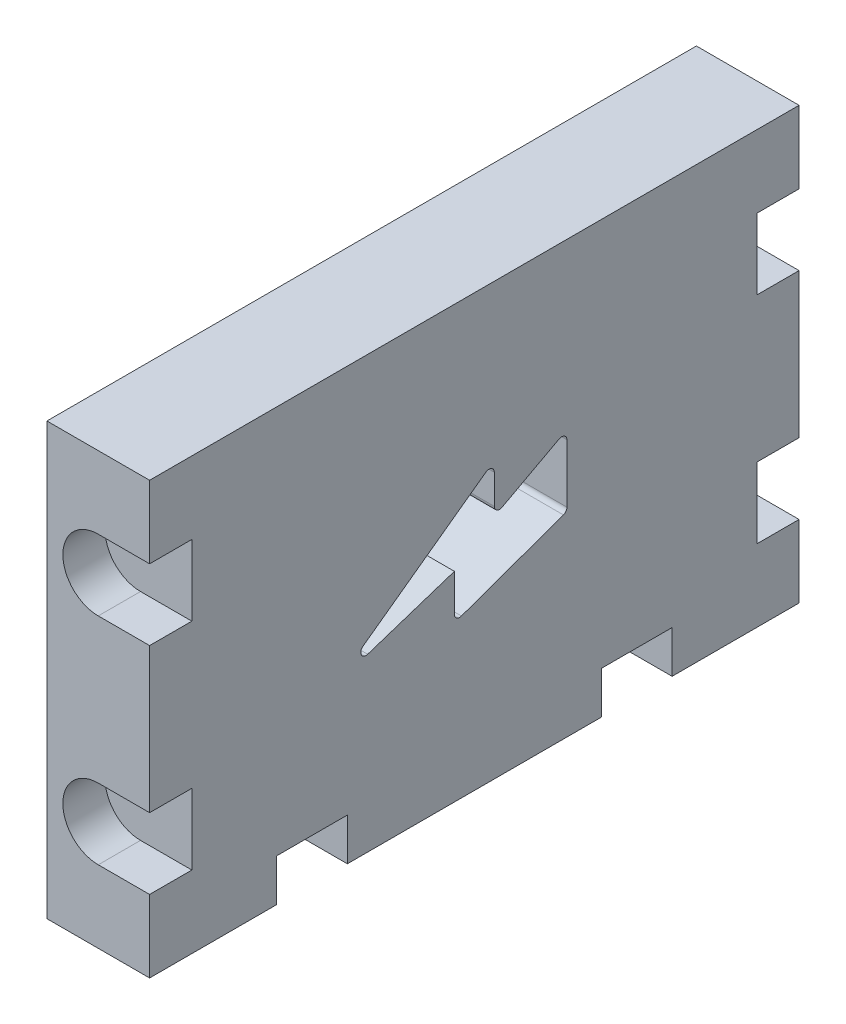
SolidWorks part; units mm, degrees
ref_plane "Front Plane" through (0, 0, 0) normal (0, 0, 1) x (1, 0, 0)
ref_plane "Top Plane" through (0, 0, 0) normal (0, 1, 0) x (1, 0, 0)
ref_plane "Right Plane" through (0, 0, 0) normal (1, 0, 0) x (0, 0, -1)
sketch "Sketch1" plane through (0, 0, 0) normal (0, 0, 1) x (1, 0, 0)
  line L6 (-810.8141, 612.9135) -> (-817.6657, 612.9135)
  line L7 (-810.8141, 612.9135) -> (-779.225, 612.9135)
  line L8 (-493.7649, 564.4955) -> (-493.7649, 1167.7963)
  line L9 (-493.7649, 1167.7963) -> (-817.6657, 1167.7963)
  line L10 (-817.6657, 1167.7963) -> (-817.6657, 564.4955)
  line L11 (-817.6657, 564.4955) -> (-493.7649, 564.4955)
  line L12 (-779.225, 612.9135) -> (-779.225, 571.3471)
  line L13 (-779.225, 571.3471) -> (-779.225, 564.4955)
  circle A2 centre (-798.6157, 583.5455) radius 2.667
extrude "Boss-Extrude1" add sketch "Sketch1" along normal blind 6.35 contours L13 L12 L7 L6 L10 L11 A2
sketch "Sketch2" plane through (0, 0, 6.35) normal (0, 0, 1) x (1, 0, 0)
  line L0 (-779.225, 564.4955) -> (-779.225, 555.0975)
  line L1 (-817.6657, 612.9135) -> (-827.0637, 612.9135)
  line L3 (-827.0637, 612.9135) -> (-779.225, 612.9135)
  line L4 (-779.225, 564.4955) -> (-779.225, 612.9135)
  line L5 (-779.225, 612.9135) -> (-817.6657, 612.9135)
  line L6 (-817.6657, 612.9135) -> (-817.6657, 564.4955)
  line L7 (-817.6657, 564.4955) -> (-779.225, 564.4955)
  line L8 (-779.225, 564.4955) -> (-779.225, 612.9135)
  line L9 (-779.225, 612.9135) -> (-817.6657, 612.9135)
  line L10 (-817.6657, 612.9135) -> (-817.6657, 564.4955)
  line L11 (-817.6657, 564.4955) -> (-779.225, 564.4955)
  line L12 (-827.0637, 612.9135) -> (-827.0637, 555.0975)
  line L13 (-827.0637, 555.0975) -> (-779.225, 555.0975)
  line L14 (-779.225, 612.9135) -> (-779.225, 555.0975)
  dimension "D2" = 9.398
  dimension "D1" = 0
extrude "Boss-Extrude2" add sketch "Sketch2" against normal up to vertex (996.0964 mm away) contours L12 L13 L0 L1 M15 M14
sketch "Sketch6" plane through (0, 0, 0) normal (0, 0, -1) x (-1, 0, 0)
  line L4 (779.225, 612.9135) -> (779.225, 555.0975)
  line L5 (779.225, 555.0975) -> (827.0637, 555.0975)
  line L6 (827.0637, 555.0975) -> (827.0637, 612.9135)
  line L7 (827.0637, 612.9135) -> (779.225, 612.9135)
  line L8 (779.225, 612.9135) -> (779.225, 555.0975)
  line L9 (779.225, 555.0975) -> (827.0637, 555.0975)
  line L10 (827.0637, 555.0975) -> (827.0637, 612.9135)
  line L11 (827.0637, 612.9135) -> (779.225, 612.9135)
  line L12 (804.9657, 562.1587) -> (817.4117, 562.1587)
  line L14 (819.1897, 562.1587) -> (820.0025, 562.1587)
  line L15 (820.0025, 562.1587) -> (820.0025, 612.9135)
  line L20 (817.4117, 562.1587) -> (819.1897, 562.1587)
  line L21 (804.9657, 562.1587) -> (779.225, 562.1587)
  dimension "D1" = 0
extrude "Boss-Extrude4" add sketch "Sketch6" along normal up to surface (78.0796 mm away) contours L12 L21 L8 L15 L14 L20 M11 M12 M13
sketch "Sketch7" plane through (0, 0, -78.0796) normal (0, 0, -1) x (-1, 0, 0)
  line L6 (805.2197, 576.9415) -> (805.2197, 612.9135)
  line L7 (779.225, 576.9415) -> (804.6609, 576.9415)
  line L8 (820.0025, 612.9135) -> (827.0637, 612.9135)
  line L9 (827.0637, 612.9135) -> (827.0637, 555.0975)
  line L10 (827.0637, 555.0975) -> (779.225, 555.0975)
  line L11 (779.225, 555.0975) -> (779.225, 562.1587)
  line L12 (779.225, 562.1587) -> (779.225, 576.9415)
  line L13 (820.0025, 612.9135) -> (805.2197, 612.9135)
  line L14 (804.6609, 576.9415) -> (805.2197, 576.9415)
  circle A2 centre (791.9609, 571.3471) radius 2.3812
  circle A3 centre (810.8141, 600.2587) radius 2.3812
sketch "Sketch8" plane through (0, 0, -78.0796) normal (0, 0, -1) x (-1, 0, 0)
  line L9 (805.2197, 612.9135) -> (805.2197, 576.9415)
  line L10 (820.0025, 612.9135) -> (805.2197, 612.9135)
  line L11 (827.0637, 612.9135) -> (820.0025, 612.9135)
  line L12 (827.0637, 555.0975) -> (827.0637, 612.9135)
  line L13 (779.225, 555.0975) -> (827.0637, 555.0975)
  line L14 (779.225, 562.1587) -> (779.225, 555.0975)
  line L15 (779.225, 576.9415) -> (779.225, 562.1587)
  line L16 (804.6609, 576.9415) -> (779.225, 576.9415)
  line L17 (805.2197, 576.9415) -> (804.6609, 576.9415)
  line L18 (805.2197, 612.9135) -> (805.2197, 576.9415)
  line L19 (820.0025, 612.9135) -> (805.2197, 612.9135)
  line L20 (827.0637, 612.9135) -> (820.0025, 612.9135)
  line L21 (827.0637, 555.0975) -> (827.0637, 612.9135)
  line L22 (779.225, 555.0975) -> (827.0637, 555.0975)
  line L23 (779.225, 562.1587) -> (779.225, 555.0975)
  line L24 (779.225, 576.9415) -> (779.225, 562.1587)
  line L25 (804.6609, 576.9415) -> (779.225, 576.9415)
  line L26 (805.2197, 576.9415) -> (804.6609, 576.9415)
  circle A1 centre (810.8141, 600.2587) radius 2.3813
  circle A2 centre (810.8141, 600.2587) radius 2.3812
  circle A3 centre (791.9609, 571.3471) radius 2.3813
  circle A4 centre (791.9609, 571.3471) radius 2.3812
  dimension "D1" = 0
  dimension "D2" = 0
  dimension "D3" = 0
extrude "Boss-Extrude6" add sketch "Sketch8" along normal blind 2.54
other "Cavity1"
other "5 SIDED ENCLOSURE 3 INCH.stp<1>@Assem11"
sketch "Sketch9" plane through (0, 612.9135, 0) normal (0, 1, 0) x (1, 0, 0)
  line L0 (-820.7645, 76.454) -> (-820.8153, 73.0504)
  line L1 (-820.8153, 3.1496) -> (-820.8153, 0)
  line L2 (-820.8153, 0) -> (-820.0025, 0)
  line L3 (-820.0025, 76.454) -> (-820.0025, 78.0796)
  line L4 (-820.0025, 78.0796) -> (-820.0025, 0)
  line L5 (-820.8153, 0) -> (-821.0693, 0)
  line L6 (-821.0693, 0) -> (-821.0693, 78.0796)
  line L7 (-821.0693, 78.0796) -> (-820.7645, 78.0796)
  line L12 (-820.7645, 76.454) -> (-820.7645, 78.0796)
  line L13 (-820.7645, 78.0796) -> (-805.2197, 78.0796)
  line L14 (-805.2197, 78.0796) -> (-805.2197, 80.6196)
  line L15 (-805.2197, 80.6196) -> (-827.0637, 80.6196)
  line L16 (-827.0637, 80.6196) -> (-827.0637, -6.35)
  line L17 (-827.0637, -6.35) -> (-779.225, -6.35)
  line L18 (-779.225, -6.35) -> (-779.225, 0)
  line L19 (-779.225, 0) -> (-820.0025, 0)
  line L20 (-820.0025, 0) -> (-820.0025, 1.0379)
  line L21 (-820.8153, 3.1496) -> (-820.8153, 73.0504)
  line L22 (-820.0025, 75.1621) -> (-820.0025, 76.454)
  line L23 (-820.0025, 76.454) -> (-820.7645, 76.454)
  line L24 (-820.7645, 76.454) -> (-820.7645, 78.0796)
  line L25 (-820.7645, 78.0796) -> (-805.2197, 78.0796)
  line L26 (-805.2197, 78.0796) -> (-805.2197, 80.6196)
  line L27 (-805.2197, 80.6196) -> (-827.0637, 80.6196)
  line L28 (-827.0637, 80.6196) -> (-827.0637, -6.35)
  line L29 (-827.0637, -6.35) -> (-779.225, -6.35)
  line L30 (-779.225, -6.35) -> (-779.225, 0)
  line L31 (-779.225, 0) -> (-820.0025, 0)
  line L32 (-820.0025, 0) -> (-820.0025, 1.0379)
  line L33 (-820.8153, 3.1496) -> (-820.8153, 73.0504)
  line L34 (-820.0025, 75.1621) -> (-820.0025, 76.454)
  line L35 (-820.0025, 76.454) -> (-820.7645, 76.454)
  arc A2 (-820.8153, 3.1496) -> (-820.0025, 1.0379) centre (-817.6657, 3.1496) ccw
  arc A3 (-820.0025, 75.1621) -> (-820.8153, 73.0504) centre (-817.6657, 73.0504) ccw
  arc A4 (-820.8153, 3.1496) -> (-820.0025, 1.0379) centre (-817.6657, 3.1496) ccw
  arc A5 (-820.0025, 75.1621) -> (-820.8153, 73.0504) centre (-817.6657, 73.0504) ccw
  dimension "D2" = 0.254
  dimension "D1" = 0
extrude "Cut-Extrude3" cut sketch "Sketch9" against normal up to surface (50.7548 mm away) contours L0 M28 M26 M27 | L7 L6 L5 L1 L0 M25 M26 M15 | L1 L2 M23 M24
sketch "Sketch10" plane through (-779.225, 0, 0) normal (1, 0, 0) x (0, 0, -1)
  line L0 (78.0796, 561.3459) -> (78.0796, 561.0919)
  line L1 (78.0796, 561.0919) -> (0, 561.0919)
  line L2 (0, 561.0919) -> (0, 562.1587)
  line L4 (24.4475, 562.1587) -> (24.4475, 561.3459) construction
  line L5 (24.4475, 562.1587) -> (24.4475, 561.3459)
  line L6 (0, 562.4127) -> (0, 562.1587)
  line L7 (0, 562.4127) -> (78.0796, 562.4127)
  line L8 (76.1963, 562.4127) -> (76.1963, 562.1587)
  line L9 (78.0796, 562.4127) -> (76.1963, 562.4127)
  line L10 (78.0796, 562.4127) -> (78.0796, 565.7277)
  line L11 (78.0796, 565.7277) -> (76.1963, 565.7277)
  line L12 (78.0796, 576.9415) -> (78.0796, 561.3459)
  line L13 (78.0796, 561.3459) -> (76.454, 561.3459)
  line L14 (76.454, 561.3459) -> (76.454, 562.1587)
  line L15 (76.454, 562.1587) -> (75.1621, 562.1587)
  line L16 (73.0504, 561.3459) -> (3.1496, 561.3459)
  line L17 (1.0379, 562.1587) -> (0, 562.1587)
  line L18 (0, 562.1587) -> (0, 612.9135)
  line L19 (0, 612.9135) -> (-6.35, 612.9135)
  line L20 (-6.35, 612.9135) -> (-6.35, 555.0975)
  line L21 (-6.35, 555.0975) -> (80.6196, 555.0975)
  line L22 (80.6196, 555.0975) -> (80.6196, 576.9415)
  line L23 (80.6196, 576.9415) -> (78.0796, 576.9415)
  line L24 (78.0796, 576.9415) -> (78.0796, 561.3459)
  line L25 (78.0796, 561.3459) -> (76.454, 561.3459)
  line L26 (76.454, 561.3459) -> (76.454, 562.1587)
  line L27 (76.454, 562.1587) -> (75.1621, 562.1587)
  line L28 (73.0504, 561.3459) -> (3.1496, 561.3459)
  line L29 (1.0379, 562.1587) -> (0, 562.1587)
  line L30 (0, 562.1587) -> (0, 612.9135)
  line L31 (0, 612.9135) -> (-6.35, 612.9135)
  line L32 (-6.35, 612.9135) -> (-6.35, 555.0975)
  line L33 (-6.35, 555.0975) -> (80.6196, 555.0975)
  line L34 (80.6196, 555.0975) -> (80.6196, 576.9415)
  line L35 (80.6196, 576.9415) -> (78.0796, 576.9415)
  line L36 (76.1963, 562.4127) -> (76.1963, 565.7277)
  line L37 (0, 561.0919) -> (3.4229, 561.0919)
  line L38 (0, 561.0919) -> (0, 564.0863)
  line L39 (0, 564.0863) -> (3.4229, 564.0863)
  line L40 (3.4229, 561.0919) -> (3.4229, 564.0863)
  arc A2 (73.0504, 561.3459) -> (75.1621, 562.1587) centre (73.0504, 564.4955) ccw
  arc A3 (1.0379, 562.1587) -> (3.1496, 561.3459) centre (3.1496, 564.4955) ccw
  arc A4 (73.0504, 561.3459) -> (75.1621, 562.1587) centre (73.0504, 564.4955) ccw
  arc A5 (1.0379, 562.1587) -> (3.1496, 561.3459) centre (3.1496, 564.4955) ccw
  dimension "D2" = 0.254
  dimension "D3" = 0.254
  dimension "D1" = 0
extrude "Cut-Extrude5" cut sketch "Sketch10" against normal up to surface (41.8444 mm away)
sketch "Sketch12" plane through (0, 0, -80.6196) normal (0, 0, -1) x (-1, 0, 0)
  line L6 (827.0637, 612.9135) -> (805.2197, 612.9135)
  line L7 (805.2197, 612.9135) -> (805.2197, 576.9415)
  line L8 (805.2197, 576.9415) -> (779.225, 576.9415)
  line L9 (779.225, 576.9415) -> (779.225, 555.0975)
  line L10 (779.225, 555.0975) -> (827.0637, 555.0975)
  line L11 (827.0637, 555.0975) -> (827.0637, 612.9135)
  line L12 (827.0637, 612.9135) -> (805.2197, 612.9135)
  line L13 (805.2197, 612.9135) -> (805.2197, 576.9415)
  line L14 (805.2197, 576.9415) -> (779.225, 576.9415)
  line L15 (779.225, 576.9415) -> (779.225, 555.0975)
  line L16 (779.225, 555.0975) -> (827.0637, 555.0975)
  line L17 (827.0637, 555.0975) -> (827.0637, 612.9135)
  circle A1 centre (791.9609, 571.3471) radius 2.3813
  circle A2 centre (791.9609, 571.3471) radius 2.3812
  circle A3 centre (810.8141, 600.2587) radius 2.3813
  circle A4 centre (810.8141, 600.2587) radius 2.3812
  dimension "D1" = 0
  dimension "D2" = 0
  dimension "D3" = 0
extrude "Boss-Extrude7" add sketch "Sketch12" along normal blind 3.81
sketch "Sketch13" plane through (0, 0, -84.4296) normal (0, 0, -1) x (-1, 0, 0)
  line L0 (797.5235, 571.3471) -> (797.5235, 576.9415)
  line L1 (805.2197, 576.9415) -> (779.225, 576.9415) construction
  line L2 (786.3983, 571.3471) -> (786.3983, 576.9415)
  line L3 (810.8141, 594.6961) -> (805.2197, 594.6961)
  line L4 (805.2197, 612.9135) -> (805.2197, 576.9415) construction
  line L5 (810.8141, 605.8213) -> (805.2197, 605.8213)
  line L12 (827.0637, 612.9135) -> (805.2197, 612.9135)
  line L13 (805.2197, 612.9135) -> (805.2197, 576.9415)
  line L14 (805.2197, 576.9415) -> (779.225, 576.9415)
  line L15 (779.225, 576.9415) -> (779.225, 555.0975)
  line L16 (779.225, 555.0975) -> (827.0637, 555.0975)
  line L17 (827.0637, 555.0975) -> (827.0637, 612.9135)
  line L18 (827.0637, 612.9135) -> (805.2197, 612.9135)
  line L19 (805.2197, 612.9135) -> (805.2197, 576.9415)
  line L20 (805.2197, 576.9415) -> (779.225, 576.9415)
  line L21 (779.225, 576.9415) -> (779.225, 555.0975)
  line L22 (779.225, 555.0975) -> (827.0637, 555.0975)
  line L23 (827.0637, 555.0975) -> (827.0637, 612.9135)
  circle A2 centre (810.8141, 600.2587) radius 3.0226
  circle A3 centre (791.9609, 571.3471) radius 3.0226
  circle A4 centre (791.9609, 571.3471) radius 5.5626
  circle A5 centre (810.8141, 600.2587) radius 5.5626
  dimension "D1" = 2.54
  dimension "D2" = 0
extrude "Cut-Extrude7" cut sketch "Sketch13" against normal blind 5.715 contours M16 | A5 A2 | A5 L5 L3 M7 | M3 | A3 M3 | A4 A3 | A4 L0 L2 M9
fillet "Fillet3" radius 1.27 4 edges at (-805.2197, 605.8213, -81.5721) (-805.2197, 594.6961, -81.5721) (-797.5235, 576.9415, -81.5721) (-786.3983, 576.9415, -81.5721)
sketch "Sketch14" plane through (0, 0, 6.35) normal (0, 0, 1) x (1, 0, 0)
  line L4 (-779.225, 612.9135) -> (-827.0637, 612.9135)
  line L5 (-827.0637, 612.9135) -> (-827.0637, 555.0975)
  line L6 (-827.0637, 555.0975) -> (-779.225, 555.0975)
  line L7 (-779.225, 555.0975) -> (-779.225, 612.9135)
  line L8 (-779.225, 612.9135) -> (-827.0637, 612.9135)
  line L9 (-827.0637, 612.9135) -> (-827.0637, 555.0975)
  line L10 (-827.0637, 555.0975) -> (-779.225, 555.0975)
  line L11 (-779.225, 555.0975) -> (-779.225, 612.9135)
  circle A1 centre (-798.6157, 583.5455) radius 12.7
  circle A2 centre (-798.6157, 583.5455) radius 12.954
  dimension "D1" = 0
  dimension "D2" = 0.254
extrude "Cut-Extrude8" cut sketch "Sketch14" against normal blind 5.715 contours A2 A1 | A1 M9 | M9
fillet "Fillet4" radius 2.54 3 edges at (-779.225, 576.9415, -81.2546) (-805.2197, 612.9135, -81.2546) (-779.225, 612.9135, 3.175)
sketch "Sketch15" plane through (-779.225, 0, 0) normal (1, 0, 0) x (0, 0, -1)
  line L4 (-6.35, 612.9135) -> (-6.35, 555.0975)
  line L5 (84.4296, 612.9135) -> (-6.35, 612.9135)
  line L6 (84.4296, 555.0975) -> (84.4296, 612.9135)
  line L7 (-6.35, 555.0975) -> (84.4296, 555.0975)
  line L8 (-6.35, 612.9135) -> (-6.35, 555.0975)
  line L9 (84.4296, 612.9135) -> (-6.35, 612.9135)
  line L10 (84.4296, 555.0975) -> (84.4296, 612.9135)
  line L11 (-6.35, 555.0975) -> (84.4296, 555.0975)
  dimension "D1" = 0
extrude "Cut-Extrude9" cut sketch "Sketch15" against normal up to surface (41.8444 mm away)
sketch "Sketch16" plane through (-827.0637, 0, 0) normal (-1, 0, 0) x (0, 0, 1)
  line L4 (6.35, 555.0975) -> (6.35, 612.9135)
  line L5 (6.35, 612.9135) -> (-84.4296, 612.9135)
  line L6 (-84.4296, 612.9135) -> (-84.4296, 555.0975)
  line L7 (-84.4296, 555.0975) -> (6.35, 555.0975)
  line L8 (6.35, 555.0975) -> (6.35, 612.9135)
  line L9 (6.35, 612.9135) -> (-84.4296, 612.9135)
  line L10 (-84.4296, 612.9135) -> (-84.4296, 555.0975)
  line L11 (-84.4296, 555.0975) -> (6.35, 555.0975)
  dimension "D1" = 0
extrude "Boss-Extrude8" add sketch "Sketch16" along normal blind 6.35
sketch "Sketch17" plane through (0, 555.0975, 0) normal (0, -1, 0) x (1, 0, 0)
  line L4 (-833.4137, -84.4296) -> (-821.0693, -84.4296)
  line L5 (-821.0693, -84.4296) -> (-821.0693, 6.35)
  line L6 (-821.0693, 6.35) -> (-833.4137, 6.35)
  line L7 (-833.4137, 6.35) -> (-833.4137, -84.4296)
  line L8 (-833.4137, -84.4296) -> (-821.0693, -84.4296)
  line L9 (-821.0693, -84.4296) -> (-821.0693, 6.35)
  line L10 (-821.0693, 6.35) -> (-833.4137, 6.35)
  line L11 (-833.4137, 6.35) -> (-833.4137, -84.4296)
  dimension "D1" = 0
extrude "Boss-Extrude9" add sketch "Sketch17" along normal up to surface (6.35 mm away)
other "Cavity2"
other "Bottom<1>@Bumper Assembly1"
other "Top<1>@Bumper Assembly1"
other "Cavity3"
other "Short Side<1>@Bumper Assembly1"
sketch "Sketch18" plane through (0, 561.0919, 0) normal (0, -1, 0) x (1, 0, 0)
  line L0 (-827.0637, 0) -> (-827.0637, -78.0796)
  line L8 (-821.0693, -78.0796) -> (-821.0693, 0)
  line L9 (-821.0693, 0) -> (-827.0637, 0)
  line L10 (-827.0637, 0) -> (-827.0637, 6.35)
  line L11 (-827.0637, 6.35) -> (-833.4137, 6.35)
  line L12 (-833.4137, 6.35) -> (-833.4137, -84.4296)
  line L13 (-833.4137, -84.4296) -> (-827.0637, -84.4296)
  line L14 (-827.0637, -84.4296) -> (-827.0637, -78.0796)
  line L15 (-827.0637, -78.0796) -> (-821.0693, -78.0796)
  line L16 (-821.0693, -78.0796) -> (-821.0693, 0)
  line L17 (-821.0693, 0) -> (-827.0637, 0)
  line L18 (-827.0637, 0) -> (-827.0637, 6.35)
  line L19 (-827.0637, 6.35) -> (-833.4137, 6.35)
  line L20 (-833.4137, 6.35) -> (-833.4137, -84.4296)
  line L21 (-833.4137, -84.4296) -> (-827.0637, -84.4296)
  line L22 (-827.0637, -84.4296) -> (-827.0637, -78.0796)
  line L23 (-827.0637, -78.0796) -> (-821.0693, -78.0796)
  dimension "D1" = 0
extrude "Boss-Extrude10" add sketch "Sketch18" along normal blind 6.223 contours L0 M12 M13 M14 M15 M16
sketch "Sketch19" plane through (-833.4137, 0, 0) normal (-1, 0, 0) x (0, 0, 1)
  line L0 (-50.1726, 593.1017) -> (-50.1726, 584.579)
  line L1 (-50.1726, 584.579) -> (-36.6428, 579.7317)
  line L2 (-36.6428, 579.7317) -> (-36.6428, 585.1117)
  line L3 (-36.6428, 585.1117) -> (-22.3673, 580.4242)
  line L4 (-22.3673, 580.4242) -> (-41.4368, 594.2736)
  line L5 (-41.4368, 594.2736) -> (-41.4368, 588.4142)
  line L6 (-41.4368, 588.4142) -> (-50.1726, 593.1017)
  line L7 (-39.0398, 561.0919) -> (-39.0398, 612.9135) construction
  line L8 (6.35, 612.9135) -> (-84.4296, 612.9135) construction
  line L9 (-41.4368, 594.2736) -> (-36.6428, 579.7317) construction
  point P11 (-39.0398, 587.0027)
  point P12 (-39.0398, 587.0027)
extrude "Cut-Extrude10" cut sketch "Sketch19" against normal through all
other "Cavity4"
other "Bumper Assembly<1>@Assem1/Short Side<1>@Bumper Assembly1"
sketch "Sketch20" plane through (-833.4137, 0, 0) normal (-1, 0, 0) x (0, 0, 1)
  line L0 (6.35, 606.5635) -> (-84.4296, 606.5635)
  line L1 (-6.35, 555.0975) -> (-6.35, 612.9135)
  line L2 (-71.7296, 612.9135) -> (-71.7296, 555.0975)
  line L4 (-84.4296, 555.0975) -> (6.35, 555.0975)
  line L5 (6.35, 555.0975) -> (6.35, 612.9135)
  line L6 (6.35, 612.9135) -> (-84.4296, 612.9135)
  line L7 (-84.4296, 612.9135) -> (-84.4296, 555.0975)
  line L9 (6.35, 555.0975) -> (6.35, 612.9135)
  line L10 (6.35, 612.9135) -> (-84.4296, 612.9135)
  line L11 (-84.4296, 612.9135) -> (-84.4296, 555.0975)
  line L15 (-84.4296, 555.0975) -> (6.35, 555.0975)
  dimension "D1" = 0
  dimension "D2" = 6.35
  dimension "D3" = 12.7
extrude "Cut-Extrude11" cut sketch "Sketch20" against normal up to surface (12.5984 mm away) contours L2 L0 L1 M8
fillet "Fillet5" radius 2.54 1 edges at (-827.2415, 606.5635, -6.35)
fillet "Fillet6" radius 2.54 1 edges at (-827.2415, 612.9135, -6.35)
sketch "Sketch21" plane through (-833.4137, 0, 0) normal (-1, 0, 0) x (0, 0, 1)
  line L0 (-27.3967, 618.0752) -> (-27.3967, 623.9576)
  line L1 (-48.4434, 610.3735) -> (-48.4434, 609.1035)
  line L2 (-14.1267, 613.4714) -> (-14.1267, 628.0114)
  line L3 (-40.6667, 616.4063) -> (-40.6667, 618.0752)
  line L4 (-40.6667, 618.0752) -> (-14.1267, 618.0752)
  line L5 (-61.1434, 612.9135) -> (-50.9834, 612.9135)
  line L6 (-61.1434, 612.9135) -> (-71.7296, 612.9135)
  line L8 (6.35, 612.9135) -> (-3.81, 612.9135)
  line L9 (-6.35, 610.3735) -> (-6.35, 609.1035)
  line L10 (-8.89, 606.5635) -> (-71.7296, 606.5635)
  line L11 (-71.7296, 606.5635) -> (-71.7296, 612.9135)
  line L12 (-71.7296, 612.9135) -> (-84.4296, 612.9135)
  line L13 (-84.4296, 612.9135) -> (-84.4296, 555.0975)
  line L14 (-84.4296, 555.0975) -> (6.35, 555.0975)
  line L15 (6.35, 555.0975) -> (6.35, 612.9135)
  line L16 (6.35, 612.9135) -> (-3.81, 612.9135)
  line L17 (-6.35, 610.3735) -> (-6.35, 609.1035)
  line L18 (-8.89, 606.5635) -> (-71.7296, 606.5635)
  line L19 (-71.7296, 606.5635) -> (-71.7296, 612.9135)
  line L20 (-71.7296, 612.9135) -> (-84.4296, 612.9135)
  line L21 (-84.4296, 612.9135) -> (-84.4296, 555.0975)
  line L22 (-84.4296, 555.0975) -> (6.35, 555.0975)
  line L23 (6.35, 555.0975) -> (6.35, 612.9135)
  arc A0 (-45.9034, 606.5635) -> (-48.4434, 609.1035) centre (-45.9034, 609.1035) cw
  arc A1 (-50.9834, 612.9135) -> (-48.4434, 610.3735) centre (-50.9834, 610.3735) cw
  arc A2 (-3.81, 612.9135) -> (-6.35, 610.3735) centre (-3.81, 610.3735) ccw
  arc A3 (-8.89, 606.5635) -> (-6.35, 609.1035) centre (-8.89, 609.1035) ccw
  arc A4 (-3.81, 612.9135) -> (-6.35, 610.3735) centre (-3.81, 610.3735) ccw
  arc A5 (-8.89, 606.5635) -> (-6.35, 609.1035) centre (-8.89, 609.1035) ccw
  dimension "D1" = 0
extrude "Boss-Extrude11" add sketch "Sketch21" against normal up to surface (12.3444 mm away) contours A1 L5 L6 L18 A0 L1 M16
other "Cavity5"
other "Bumper Assembly<1>@CORNER MOUNT ASSEMBLY/Bottom<1>@Bumper Assembly1"
other "Bumper Assembly<1>@CORNER MOUNT ASSEMBLY/Top<1>@Bumper Assembly1"
other "Cavity6"
other "Bumper Assembly<1>@CORNER MOUNT ASSEMBLY/Short Side<1>@Bumper Assembly1"
sketch "Sketch22" plane through (-833.4137, 0, 0) normal (-1, 0, 0) x (0, 0, 1)
  line L0 (-3.81, 612.9135) -> (-50.9834, 612.9135)
  line L8 (-78.0796, 561.0919) -> (0, 561.0919)
  line L9 (0, 561.0919) -> (0, 612.9135)
  line L10 (0, 612.9135) -> (-3.81, 612.9135)
  line L11 (-6.35, 610.3735) -> (-6.35, 609.1035)
  line L12 (-8.89, 606.5635) -> (-45.9034, 606.5635)
  line L13 (-48.4434, 609.1035) -> (-48.4434, 610.3735)
  line L14 (-50.9834, 612.9135) -> (-78.0796, 612.9135)
  line L15 (-78.0796, 612.9135) -> (-78.0796, 561.0919)
  line L16 (-78.0796, 561.0919) -> (0, 561.0919)
  line L17 (0, 561.0919) -> (0, 612.9135)
  line L18 (0, 612.9135) -> (-3.81, 612.9135)
  line L19 (-6.35, 610.3735) -> (-6.35, 609.1035)
  line L20 (-8.89, 606.5635) -> (-45.9034, 606.5635)
  line L21 (-48.4434, 609.1035) -> (-48.4434, 610.3735)
  line L22 (-50.9834, 612.9135) -> (-78.0796, 612.9135)
  line L23 (-78.0796, 612.9135) -> (-78.0796, 561.0919)
  arc A4 (-3.81, 612.9135) -> (-6.35, 610.3735) centre (-3.81, 610.3735) ccw
  arc A5 (-8.89, 606.5635) -> (-6.35, 609.1035) centre (-8.89, 609.1035) ccw
  arc A6 (-48.4434, 609.1035) -> (-45.9034, 606.5635) centre (-45.9034, 609.1035) ccw
  arc A7 (-48.4434, 610.3735) -> (-50.9834, 612.9135) centre (-50.9834, 610.3735) ccw
  arc A8 (-3.81, 612.9135) -> (-6.35, 610.3735) centre (-3.81, 610.3735) ccw
  arc A9 (-8.89, 606.5635) -> (-6.35, 609.1035) centre (-8.89, 609.1035) ccw
  arc A10 (-48.4434, 609.1035) -> (-45.9034, 606.5635) centre (-45.9034, 609.1035) ccw
  arc A11 (-48.4434, 610.3735) -> (-50.9834, 612.9135) centre (-50.9834, 610.3735) ccw
  dimension "D1" = 0
extrude "Boss-Extrude12" add sketch "Sketch22" against normal up to surface (12.3444 mm away) contours L0 M16 M22 M21 M20 M19 M18 M17
sketch "Sketch23" plane through (0, 0, -78.0796) normal (0, 0, -1) x (-1, 0, 0)
  circle A2 centre (827.2415, 574.0473) radius 2.05 construction
  circle A3 centre (827.2415, 599.9581) radius 2.05 construction
  circle A4 centre (827.2415, 599.9581) radius 4.2545
  circle A5 centre (827.2415, 574.0473) radius 4.2545
  dimension "D1" = 8.509
extrude "Cut-Extrude12" cut sketch "Sketch23" against normal blind 5.08
sketch "Sketch24" plane through (0, 0, 0) normal (0, 0, 1) x (1, 0, 0)
  circle A0 centre (-827.2415, 574.0473) radius 4.2545 construction
  circle A1 centre (-827.2415, 599.9581) radius 4.2545 construction
  circle A2 centre (-827.2415, 574.0473) radius 4.2545
  circle A3 centre (-827.2415, 599.9581) radius 4.2545
extrude "Cut-Extrude13" cut sketch "Sketch24" against normal blind 5.08
sketch "Sketch25" plane through (0, 561.0919, 0) normal (0, -1, 0) x (1, 0, 0)
  circle A2 centre (-827.2415, -58.5597) radius 2.05 construction
  circle A3 centre (-827.2415, -19.5199) radius 2.05 construction
  circle A4 centre (-827.2415, -19.5199) radius 4.2545
  circle A5 centre (-827.2415, -58.5597) radius 4.2545
  dimension "D1" = 8.509
extrude "Cut-Extrude14" cut sketch "Sketch25" against normal blind 5.08
sketch "Sketch26" plane through (0, 0, -78.0796) normal (0, 0, -1) x (-1, 0, 0)
  line L0 (827.2415, 569.7928) -> (821.0693, 569.7928)
  line L1 (827.2415, 578.3018) -> (821.0693, 578.3018)
  line L2 (827.2415, 595.7036) -> (821.0693, 595.7036)
  line L3 (827.2415, 604.2126) -> (821.0693, 604.2126)
  line L4 (821.0693, 561.0919) -> (833.4137, 561.0919)
  line L5 (833.4137, 561.0919) -> (833.4137, 612.9135)
  line L6 (833.4137, 612.9135) -> (821.0693, 612.9135)
  line L7 (821.0693, 612.9135) -> (821.0693, 561.0919)
  line L8 (821.0693, 561.0919) -> (833.4137, 561.0919)
  line L9 (833.4137, 561.0919) -> (833.4137, 612.9135)
  line L10 (833.4137, 612.9135) -> (821.0693, 612.9135)
  line L11 (821.0693, 612.9135) -> (821.0693, 561.0919)
  circle A1 centre (827.2415, 599.9581) radius 4.2545
  circle A2 centre (827.2415, 599.9581) radius 4.2545
  circle A3 centre (827.2415, 574.0473) radius 4.2545
  circle A4 centre (827.2415, 574.0473) radius 4.2545
  dimension "D1" = 0
  dimension "D2" = 0
  dimension "D3" = 0
extrude "Cut-Extrude15" cut sketch "Sketch26" against normal up to surface (5.08 mm away) contours L3 L2 M7 M12 | L1 L0 M8 M12
sketch "Sketch27" plane through (0, 561.0919, 0) normal (0, -1, 0) x (1, 0, 0)
  line L0 (-827.2415, -62.8142) -> (-821.0693, -62.8142)
  line L1 (-827.2415, -54.3052) -> (-821.0693, -54.3052)
  line L2 (-827.2415, -23.7744) -> (-821.0693, -23.7744)
  line L3 (-827.2415, -15.2654) -> (-821.0693, -15.2654)
  line L4 (-821.0693, 0) -> (-833.4137, 0)
  line L5 (-833.4137, 0) -> (-833.4137, -78.0796)
  line L6 (-833.4137, -78.0796) -> (-821.0693, -78.0796)
  line L7 (-821.0693, -78.0796) -> (-821.0693, 0)
  line L8 (-821.0693, 0) -> (-833.4137, 0)
  line L9 (-833.4137, 0) -> (-833.4137, -78.0796)
  line L10 (-833.4137, -78.0796) -> (-821.0693, -78.0796)
  line L11 (-821.0693, -78.0796) -> (-821.0693, 0)
  circle A1 centre (-827.2415, -19.5199) radius 4.2545
  circle A2 centre (-827.2415, -19.5199) radius 4.2545
  circle A3 centre (-827.2415, -58.5597) radius 4.2545
  circle A4 centre (-827.2415, -58.5597) radius 4.2545
  dimension "D1" = 0
  dimension "D2" = 0
  dimension "D3" = 0
extrude "Cut-Extrude16" cut sketch "Sketch27" against normal up to surface (5.08 mm away) contours L3 L2 M7 M12 | L1 L0 M8 M12
sketch "Sketch28" plane through (0, 0, 0) normal (0, 0, 1) x (1, 0, 0)
  line L0 (-827.2415, 578.3018) -> (-821.0693, 578.3018)
  line L1 (-827.2415, 569.7928) -> (-821.0693, 569.7928)
  line L2 (-827.2415, 595.7036) -> (-821.0693, 595.7036)
  line L3 (-827.2415, 604.2126) -> (-821.0693, 604.2126)
  line L4 (-833.4137, 612.9135) -> (-833.4137, 561.0919)
  line L5 (-833.4137, 561.0919) -> (-821.0693, 561.0919)
  line L6 (-821.0693, 561.0919) -> (-821.0693, 612.9135)
  line L7 (-821.0693, 612.9135) -> (-833.4137, 612.9135)
  line L8 (-833.4137, 612.9135) -> (-833.4137, 561.0919)
  line L9 (-833.4137, 561.0919) -> (-821.0693, 561.0919)
  line L10 (-821.0693, 561.0919) -> (-821.0693, 612.9135)
  line L11 (-821.0693, 612.9135) -> (-833.4137, 612.9135)
  circle A1 centre (-827.2415, 574.0473) radius 4.2545
  circle A2 centre (-827.2415, 574.0473) radius 4.2545
  circle A3 centre (-827.2415, 599.9581) radius 4.2545
  circle A4 centre (-827.2415, 599.9581) radius 4.2545
  dimension "D1" = 0
  dimension "D2" = 0
  dimension "D3" = 0
extrude "Cut-Extrude17" cut sketch "Sketch28" against normal up to surface (5.08 mm away) contours L3 L2 M9 M12 | L1 L0 M8 M12
fillet "Fillet7" radius 0.635 6 edges at (-827.2415, 594.2736, -41.4368) (-827.2415, 588.4142, -41.4368) (-827.2415, 593.1017, -50.1726) (-827.2415, 584.579, -50.1726) (-827.2415, 579.7317, -36.6428) (-827.2415, 580.4242, -22.3673)
